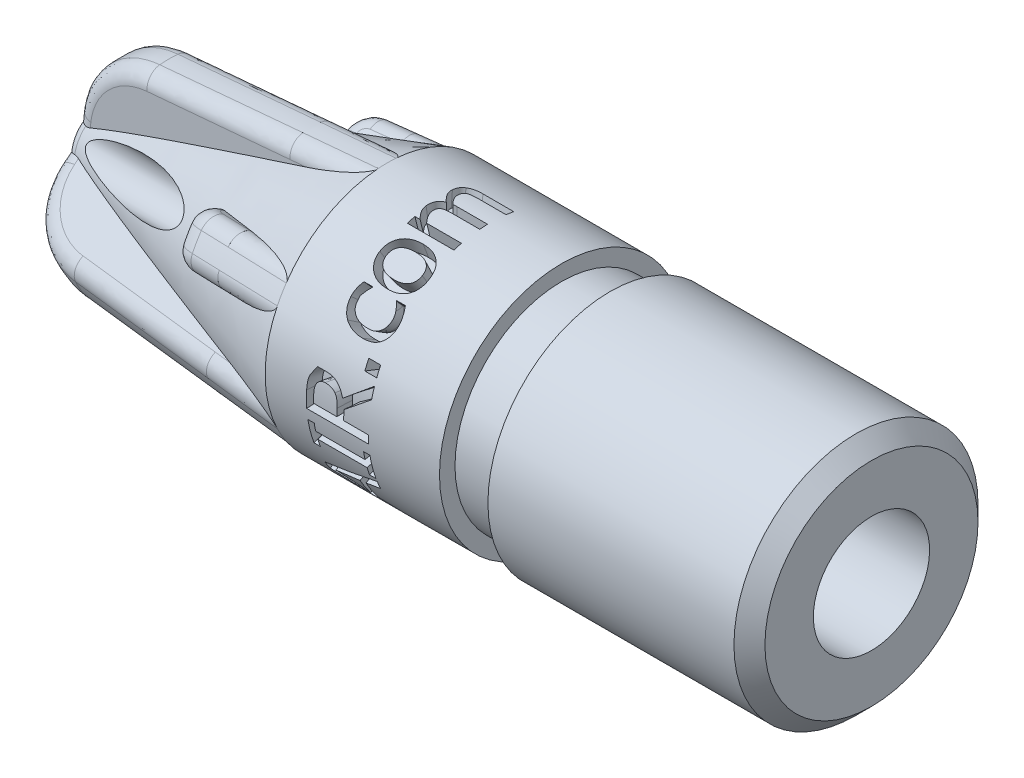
SolidWorks part; units mm, degrees
ref_plane "Front Plane" through (0, 0, 0) normal (0, 0, 1) x (1, 0, 0)
ref_plane "Top Plane" through (0, 0, 0) normal (0, 1, 0) x (1, 0, 0)
ref_plane "Right Plane" through (0, 0, 0) normal (1, 0, 0) x (0, 0, -1)
imported_body "Imported3"
ref_plane "Plane1" through (-14.9781, 0, 0) normal (-1, 0, 0) x (0, -1, 0)
sketch "Sketch1" plane through (-14.9781, 0, 0) normal (-1, 0, 0) x (0, -1, 0)
  circle A0 centre (-1.4833, 0) radius 2
extrude "Boss-Extrude1" add sketch "Sketch1" against normal blind 4.2862
sketch "Sketch2" plane through (-18.6269, 0, 0) normal (-1, 0, 0) x (0, 0, 1)
  arc A0 (-0.6026, 2.2206) -> (-0.9398, 1.6365) centre (-0.8249, 1.9595) ccw
  arc A1 (-0.9398, 1.6365) -> (-0.6026, 2.2206) centre (0, 1.4833) cw
extrude "Cut-Extrude1" cut sketch "Sketch2" against normal blind 2.3788
sketch "Sketch3" plane through (-18.6269, 0, 0) normal (-1, 0, 0) x (0, 0, 1)
  arc A0 (-0.3373, 0.5927) -> (0.3373, 0.5927) centre (0, 0.5308) ccw
  arc A1 (0.3373, 0.5927) -> (-0.3373, 0.5927) centre (0, 1.4833) cw
extrude "Cut-Extrude2" cut sketch "Sketch3" against normal blind 2.3788
sketch "Sketch4" plane through (-18.6269, 0, 0) normal (-1, 0, 0) x (0, 0, 1)
  arc A0 (0.9398, 1.6365) -> (0.6026, 2.2206) centre (0.8249, 1.9595) ccw
  arc A1 (0.6026, 2.2206) -> (0.9398, 1.6365) centre (0, 1.4833) cw
extrude "Cut-Extrude3" cut sketch "Sketch4" against normal blind 2.3788
sketch "Sketch5" plane through (0, 0, 0) normal (0, 0, 1) x (1, 0, 0)
  line L0 (-18.6269, 2.4355) -> (-18.6269, 1.4833)
  line L1 (-18.6269, 1.4833) -> (-10.6918, 1.4833)
  line L2 (-10.6918, 1.4833) -> (-10.6918, 2.4355)
  line L3 (-10.6918, 2.4355) -> (-18.6269, 2.4355)
  line L4 (-18.6269, 1.4833) -> (-10.6918, 1.4833) construction
revolve "Cut-Revolve1" cut sketch "Sketch5" angle 360 about L4
sketch "Sketch6" plane through (0, 0, 0) normal (0, 0, 1) x (1, 0, 0)
  line L0 (-19.8335, 1.4963) -> (-19.8335, 1.4833)
  line L1 (-19.8335, 1.4833) -> (-19.3006, 1.4833)
  line L2 (-19.3006, 1.4833) -> (-19.3006, 2.2231)
  line L3 (-19.8335, 1.4833) -> (-19.3006, 1.4833) construction
  arc A0 (-19.3006, 2.2231) -> (-19.8335, 1.4963) centre (-19.0715, 1.4963) ccw
revolve "Cut-Revolve2" cut sketch "Sketch6" angle 360 about L3
fillet "Fillet1" radius 0.381 3 edges at (-20.4831, 2.4022, -1.5916) (-20.4831, -0.3546, 0) (-20.4831, 2.4022, 1.5916)
fillet "Fillet2" radius 1.27 3 edges at (-23.1122, 0.6794, 1.3924) (-23.1122, 3.0911, 0) (-23.1122, 0.6794, -1.3924)
fillet "VarFillet1" radius 0.2401 1 edges at (-17.032, 2.5336, 1.517)
fillet "VarFillet2" radius 0.1525 1 edges at (-17.7596, 1.8083, 1.8608)
fillet "VarFillet4" radius 0.3401 1 edges at (-16.92, 2.6006, 1.5133)
chamfer "Chamfer1" distance 0.254 angle 45 1 edges at (-10.6918, 1.4833, -2)
fillet "Fillet3" radius 0.254 33 edges at (-22.9725, 1.1703, 1.3041) (-22.955, 2.7863, 0.381) (-23.3648, 1.7367, 0.439) (-20.3884, -0.2145, 0.381) (-22.955, 0.5018, 0.9379) (-23.3648, 0.9763, 0) (-22.9725, 0.5104, -0.9231) (-20.3616, 2.6762, -1.3043) (-20.3884, 2.6621, 1.2798) (-20.3616, -0.2428, -0.381) (-22.9725, 2.7691, -0.381) (-22.955, 1.1617, -1.3189) (-23.3648, 1.7367, -0.439) (-20.3884, 2.0022, -1.6608) (-20.3616, 2.0163, 1.6853)
